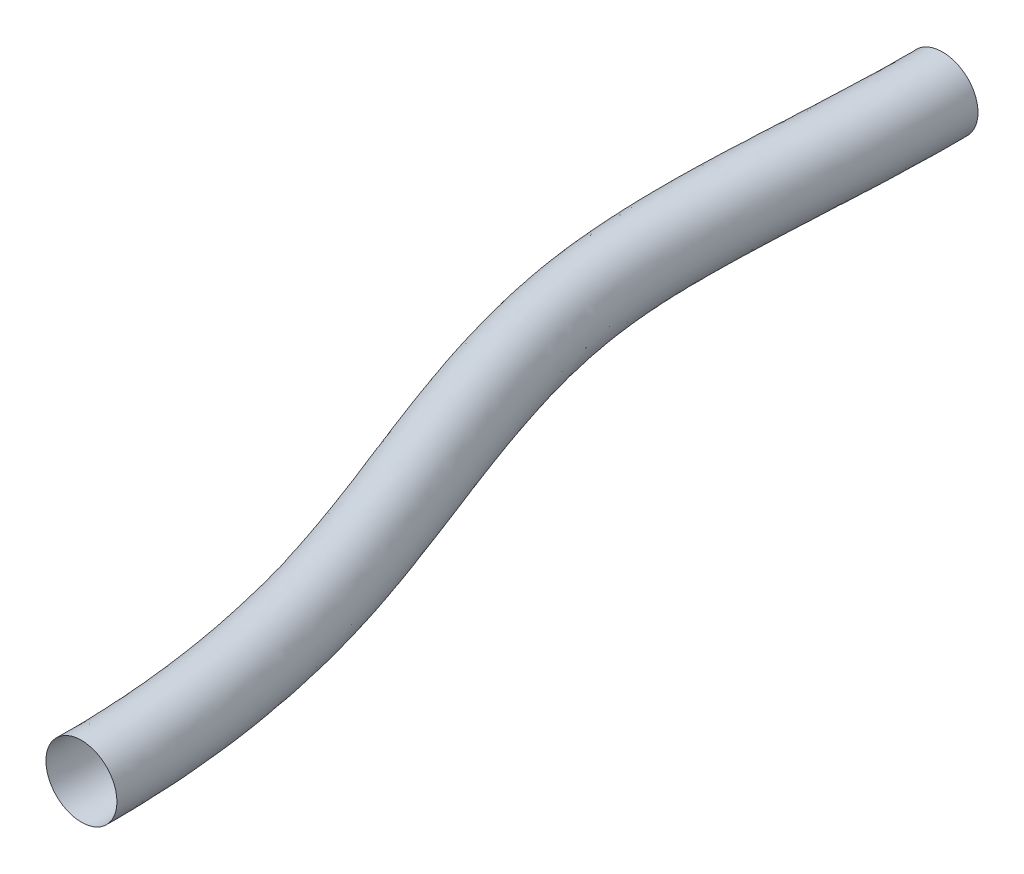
SolidWorks part; units mm, degrees
ref_plane "Front" through (0, 0, 0) normal (0, 0, 1) x (1, 0, 0)
ref_plane "Top" through (0, 0, 0) normal (0, 1, 0) x (1, 0, 0)
ref_plane "Right" through (0, 0, 0) normal (1, 0, 0) x (0, 0, -1)
sketch "Sketch1" plane through (0, 0, 0) normal (0, 0, 1) x (1, 0, 0)
  circle A0 centre (0, 0) radius 3.175
sketch "Sketch2" plane through (0, 0, 0) normal (0, 1, 0) x (1, 0, 0)
  spline S0 degree 3 poles (0.1042, -1.1588) (0.3078, 7.8489) (-2.7641, 28.9795) (-18.4017, 58.0583) (-14.6237, 81.3972) (-14.7541, 91.8322) knots 0 0 0 0 0.282507 0.670237 1 1 1 1
surface "Surface-Sweep1"
